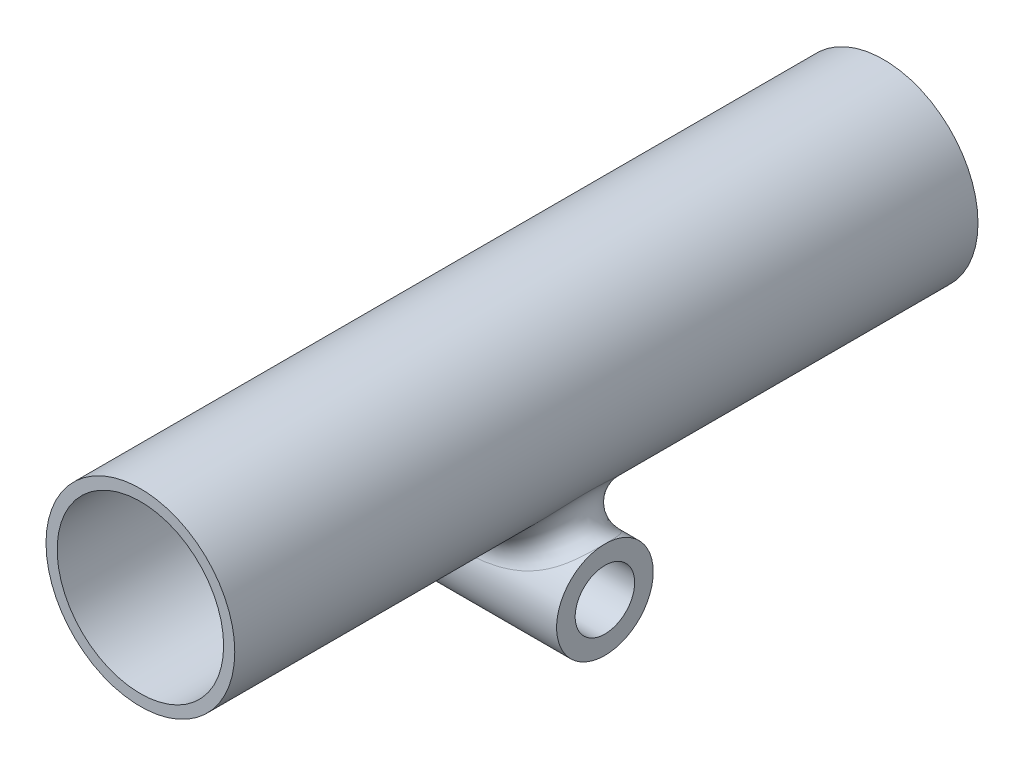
SolidWorks part; units mm, degrees
ref_plane "Front Plane" through (0, 0, 0) normal (0, 0, 1) x (1, 0, 0)
ref_plane "Top Plane" through (0, 0, 0) normal (0, 1, 0) x (1, 0, 0)
ref_plane "Right Plane" through (0, 0, 0) normal (1, 0, 0) x (0, 0, -1)
sketch "Sketch1" plane through (0, 0, 0) normal (0, 0, 1) x (1, 0, 0)
  circle A0 centre (0, 0) radius 12.7
  circle A1 centre (0, 0) radius 11.2
  dimension "D1" = 25.4
  dimension "D2" = 1.5
extrude "Boss-Extrude1" add sketch "Sketch1" along normal blind 100
sketch "Sketch2" plane through (0, 0, 0) normal (1, 0, 0) x (0, 0, -1)
  line L0 (0, 0) -> (0, -19) construction
  line L1 (0, -19) -> (-50, -19) construction
  circle A0 centre (-50, -19) radius 4
  circle A1 centre (-50, -19) radius 6.5
  dimension "D1" = 8
  dimension "D2" = 13
  dimension "D3" = 19
  dimension "D4" = 50
extrude "Boss-Extrude2" add sketch "Sketch2" along normal mid plane 25
fillet "Fillet1" radius 3 1 edges at (0.2572, -12.6974, 48.4103)
